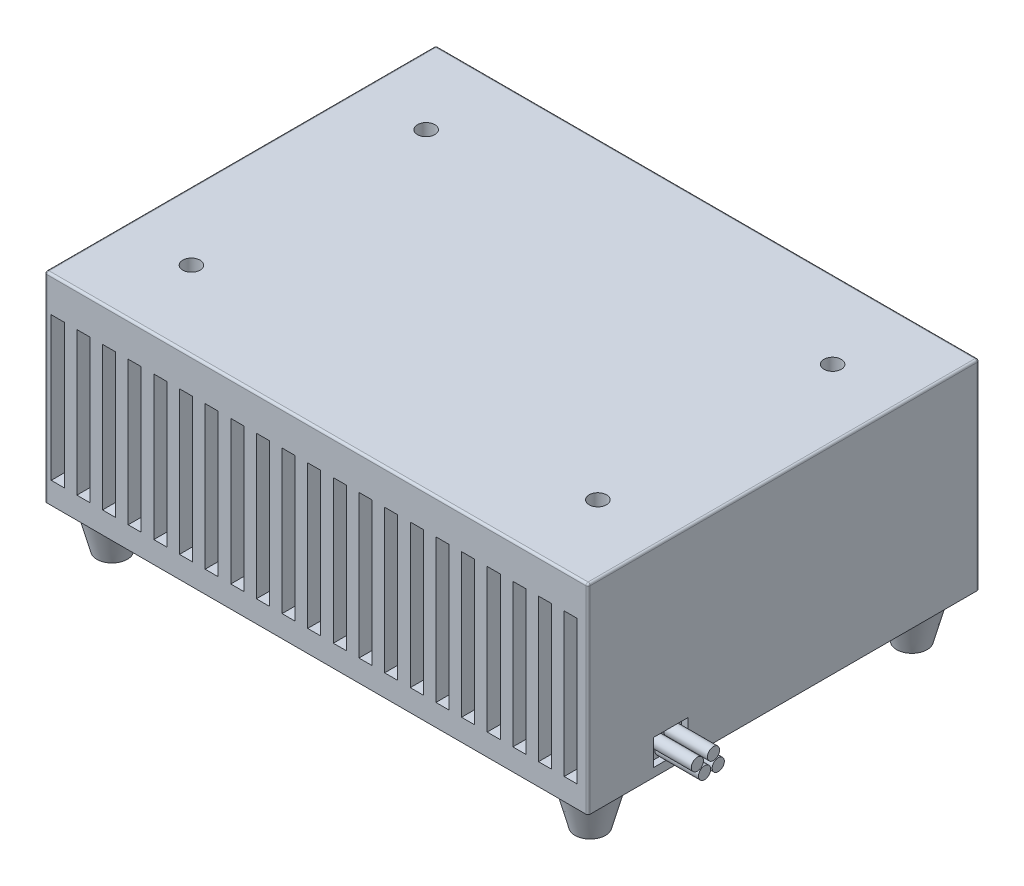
SolidWorks part; units mm, degrees
ref_plane "Front Plane" through (0, 0, 0) normal (0, 0, 1) x (1, 0, 0)
ref_plane "Top Plane" through (0, 0, 0) normal (0, 1, 0) x (1, 0, 0)
ref_plane "Right Plane" through (0, 0, 0) normal (1, 0, 0) x (0, 0, -1)
sketch "Sketch1" plane through (0, 0, 0) normal (0, 1, 0) x (1, 0, 0)
  line L1 (-62.5, -45) -> (62.5, -45)
  line L2 (-62.5, -45) -> (-62.5, 45)
  line L3 (-62.5, 45) -> (62.5, 45)
  line L4 (62.5, -45) -> (62.5, 45)
  line L5 (-62.5, -45) -> (62.5, 45) construction
  line L6 (-62.5, 45) -> (62.5, -45) construction
  point P0 (0, 0)
  dimension "D1" = 125
  dimension "D2" = 90
extrude "Boss-Extrude1" add sketch "Sketch1" along normal blind 56
sketch "Sketch2" plane through (0, 0, 45) normal (0, 0, 1) x (1, 0, 0)
  line L0 (-62.5, 0) -> (62.5, 0) construction
  line L1 (-61, 15) -> (-58, 15)
  line L2 (-61, 15) -> (-61, 48)
  line L3 (-61, 48) -> (-58, 48)
  line L4 (-58, 15) -> (-58, 48)
  line L5 (-62.5, 56) -> (62.5, 56) construction
  line L6 (-62.5, 56) -> (-62.5, 0) construction
  line L7 (-55.1, 15) -> (-55.1, 48)
  line L8 (-55.1, 15) -> (-52.1, 15)
  line L9 (-52.1, 15) -> (-52.1, 48)
  line L10 (-55.1, 48) -> (-52.1, 48)
  line L11 (-49.2, 15) -> (-49.2, 48)
  line L12 (-49.2, 15) -> (-46.2, 15)
  line L13 (-46.2, 15) -> (-46.2, 48)
  line L14 (-49.2, 48) -> (-46.2, 48)
  line L15 (-43.3, 15) -> (-43.3, 48)
  line L16 (-43.3, 15) -> (-40.3, 15)
  line L17 (-40.3, 15) -> (-40.3, 48)
  line L18 (-43.3, 48) -> (-40.3, 48)
  line L19 (-37.4, 15) -> (-37.4, 48)
  line L20 (-37.4, 15) -> (-34.4, 15)
  line L21 (-34.4, 15) -> (-34.4, 48)
  line L22 (-37.4, 48) -> (-34.4, 48)
  line L23 (-31.5, 15) -> (-31.5, 48)
  line L24 (-31.5, 15) -> (-28.5, 15)
  line L25 (-28.5, 15) -> (-28.5, 48)
  line L26 (-31.5, 48) -> (-28.5, 48)
  line L27 (-25.6, 15) -> (-25.6, 48)
  line L28 (-25.6, 15) -> (-22.6, 15)
  line L29 (-22.6, 15) -> (-22.6, 48)
  line L30 (-25.6, 48) -> (-22.6, 48)
  line L31 (-19.7, 15) -> (-19.7, 48)
  line L32 (-19.7, 15) -> (-16.7, 15)
  line L33 (-16.7, 15) -> (-16.7, 48)
  line L34 (-19.7, 48) -> (-16.7, 48)
  line L35 (-13.8, 15) -> (-13.8, 48)
  line L36 (-13.8, 15) -> (-10.8, 15)
  line L37 (-10.8, 15) -> (-10.8, 48)
  line L38 (-13.8, 48) -> (-10.8, 48)
  line L39 (-7.9, 15) -> (-7.9, 48)
  line L40 (-7.9, 15) -> (-4.9, 15)
  line L41 (-4.9, 15) -> (-4.9, 48)
  line L42 (-7.9, 48) -> (-4.9, 48)
  line L43 (-2, 15) -> (-2, 48)
  line L44 (-2, 15) -> (1, 15)
  line L45 (1, 15) -> (1, 48)
  line L46 (-2, 48) -> (1, 48)
  line L47 (3.9, 15) -> (3.9, 48)
  line L48 (3.9, 15) -> (6.9, 15)
  line L49 (6.9, 15) -> (6.9, 48)
  line L50 (3.9, 48) -> (6.9, 48)
  line L51 (9.8, 15) -> (9.8, 48)
  line L52 (9.8, 15) -> (12.8, 15)
  line L53 (12.8, 15) -> (12.8, 48)
  line L54 (9.8, 48) -> (12.8, 48)
  line L55 (15.7, 15) -> (15.7, 48)
  line L56 (15.7, 15) -> (18.7, 15)
  line L57 (18.7, 15) -> (18.7, 48)
  line L58 (15.7, 48) -> (18.7, 48)
  line L59 (21.6, 15) -> (21.6, 48)
  line L60 (21.6, 15) -> (24.6, 15)
  line L61 (24.6, 15) -> (24.6, 48)
  line L62 (21.6, 48) -> (24.6, 48)
  line L63 (27.5, 15) -> (27.5, 48)
  line L64 (27.5, 15) -> (30.5, 15)
  line L65 (30.5, 15) -> (30.5, 48)
  line L66 (27.5, 48) -> (30.5, 48)
  line L67 (33.4, 15) -> (33.4, 48)
  line L68 (33.4, 15) -> (36.4, 15)
  line L69 (36.4, 15) -> (36.4, 48)
  line L70 (33.4, 48) -> (36.4, 48)
  line L71 (39.3, 15) -> (39.3, 48)
  line L72 (39.3, 15) -> (42.3, 15)
  line L73 (42.3, 15) -> (42.3, 48)
  line L74 (39.3, 48) -> (42.3, 48)
  line L75 (45.2, 15) -> (45.2, 48)
  line L76 (45.2, 15) -> (48.2, 15)
  line L77 (48.2, 15) -> (48.2, 48)
  line L78 (45.2, 48) -> (48.2, 48)
  line L79 (51.1, 15) -> (51.1, 48)
  line L80 (51.1, 15) -> (54.1, 15)
  line L81 (54.1, 15) -> (54.1, 48)
  line L82 (51.1, 48) -> (54.1, 48)
  line L83 (57, 15) -> (57, 48)
  line L84 (57, 15) -> (60, 15)
  line L85 (60, 15) -> (60, 48)
  line L86 (57, 48) -> (60, 48)
  dimension "D1" = 15
  dimension "D2" = 8
  dimension "D3" = 1.5
  dimension "D4" = 3
  dimension "D5" = 21
extrude "Cut-Extrude1" cut sketch "Sketch2" against normal blind 56
fillet "Fillet1" radius 0.5 11 edges at (-62.5, 28, 45) (-62.5, 0, 0) (-62.5, 28, -45) (0, 0, -45) (62.5, 28, 45) (62.5, 28, -45) (62.5, 0, 0) (0, 56, 45) (-62.5, 56, 0) (0, 56, -45) (62.5, 56, 0)
sketch "Sketch3" plane through (0, 0, 0) normal (0, -1, 0) x (1, 0, 0)
  line L1 (-55, -37) -> (55, -37) construction
  line L2 (-55, -37) -> (-55, 37) construction
  line L3 (-55, 37) -> (55, 37) construction
  line L4 (55, -37) -> (55, 37) construction
  line L5 (-55, -37) -> (55, 37) construction
  line L6 (-55, 37) -> (55, -37) construction
  line L7 (-82.7801, -64.9887) -> (82.7801, -64.9887)
  line L8 (-82.7801, -64.9887) -> (-82.7801, 64.9887)
  line L9 (-82.7801, 64.9887) -> (82.7801, 64.9887)
  line L10 (82.7801, -64.9887) -> (82.7801, 64.9887)
  line L11 (-82.7801, -64.9887) -> (82.7801, 64.9887) construction
  line L12 (-82.7801, 64.9887) -> (82.7801, -64.9887) construction
  circle A0 centre (-55, 37) radius 3.5
  circle A1 centre (55, 37) radius 3.5
  circle A2 centre (55, -37) radius 3.5
  circle A3 centre (-55, -37) radius 3.5
  point P0 (0, 0)
  point P10 (0, 0)
  point P15 (-82.7801, 64.9887)
  dimension "D3" = 7
  dimension "D1" = 110
  dimension "D2" = 74
extrude "Cut-Extrude2" cut sketch "Sketch3" against normal blind 10 draft 15
sketch "Sketch4" plane through (62.5, 0, 0) normal (1, 0, 0) x (0, 0, -1)
  line L0 (-45, 10) -> (-45, 55.5) construction
  line L1 (-30, 12) -> (-22, 12)
  line L2 (-30, 12) -> (-30, 18)
  line L3 (-30, 18) -> (-22, 18)
  line L4 (-22, 12) -> (-22, 18)
  line L5 (-44.5, 10) -> (44.5, 10) construction
  dimension "D1" = 8
  dimension "D2" = 6
  dimension "D3" = 15
  dimension "D4" = 2
extrude "Cut-Extrude3" cut sketch "Sketch4" against normal blind 1.5
sketch "Sketch5" plane through (61, 0, 0) normal (1, 0, 0) x (0, 0, -1)
  circle A0 centre (-28.3584, 16.1304) radius 1.4
  circle A1 centre (-24.6389, 16.3975) radius 1.4
  circle A2 centre (-23.5498, 13.6233) radius 1.4
  circle A3 centre (-26.6939, 13.6028) radius 1.4
  dimension "D1" = 2.8
extrude "Boss-Extrude2" add sketch "Sketch5" along normal blind 10
sketch "Sketch6" plane through (0, 56, 0) normal (0, 1, 0) x (1, 0, 0)
  line L1 (46.75, -27) -> (-46.75, -27) construction
  line L2 (46.75, -27) -> (46.75, 27) construction
  line L3 (46.75, 27) -> (-46.75, 27) construction
  line L4 (-46.75, -27) -> (-46.75, 27) construction
  line L5 (46.75, -27) -> (-46.75, 27) construction
  line L6 (46.75, 27) -> (-46.75, -27) construction
  circle A0 centre (-46.75, 27) radius 2
  circle A1 centre (46.75, 27) radius 2
  circle A2 centre (46.75, -27) radius 2
  circle A3 centre (-46.75, -27) radius 2
  point P0 (0, 0)
  dimension "D3" = 4
  dimension "D1" = 93.5
  dimension "D2" = 54
extrude "Cut-Extrude6" cut sketch "Sketch6" against normal blind 8
